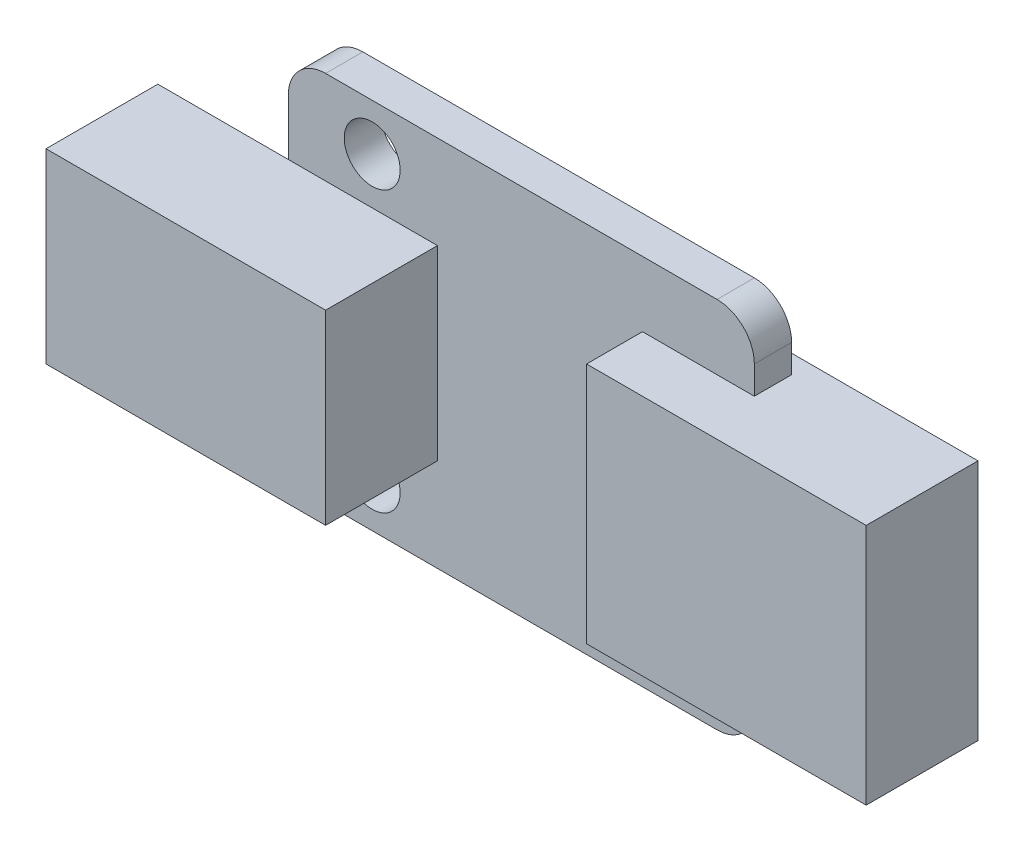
SolidWorks part; units mm, degrees
ref_plane "Front Plane" through (0, 0, 0) normal (0, 0, 1) x (1, 0, 0)
ref_plane "Top Plane" through (0, 0, 0) normal (0, 1, 0) x (1, 0, 0)
ref_plane "Right Plane" through (0, 0, 0) normal (1, 0, 0) x (0, 0, -1)
sketch "Sketch3" plane through (0, 0, 0) normal (0, 0, 1) x (1, 0, 0)
  line L1 (-12.5, 10) -> (12.5, 10)
  line L2 (-12.5, 10) -> (-12.5, -10)
  line L3 (-12.5, -10) -> (12.5, -10)
  line L4 (12.5, 10) -> (12.5, -10)
  line L5 (-12.5, 10) -> (12.5, -10) construction
  line L6 (-12.5, -10) -> (12.5, 10) construction
  circle A0 centre (-8, 7.5) radius 1.5
  circle A1 centre (-8, -7.5) radius 1.5
  point P0 (0, 0)
  dimension "D3" = 3
  dimension "D4" = 3
  dimension "D1" = 20
  dimension "D2" = 25
  dimension "D5" = 2.5
  dimension "D6" = 2.5
  dimension "D7" = 4.5
  dimension "D8" = 4.5
extrude "Boss-Extrude1" add sketch "Sketch3" along normal blind 2
sketch "Sketch4" plane through (0, 0, 2) normal (0, 0, 1) x (1, 0, 0)
  line L0 (12.5, -10) -> (12.5, 10) construction
  line L1 (6.5, -6.5) -> (21.5, -6.5)
  line L2 (6.5, -6.5) -> (6.5, 6.5)
  line L3 (6.5, 6.5) -> (21.5, 6.5)
  line L4 (21.5, -6.5) -> (21.5, 6.5)
  line L5 (6.5, -6.5) -> (21.5, 6.5) construction
  line L6 (6.5, 6.5) -> (21.5, -6.5) construction
  point P0 (14, 0)
  point P5 (16.2173, 0)
  dimension "D1" = 13
  dimension "D2" = 15
  dimension "D3" = 6
extrude "Boss-Extrude2" add sketch "Sketch4" along normal mid plane 6
sketch "Sketch5" plane through (0, 0, 2) normal (0, 0, 1) x (1, 0, 0)
  line L0 (-12.5, 10) -> (-12.5, -10) construction
  line L1 (-4.5, 5) -> (-19.5, 5)
  line L2 (-4.5, 5) -> (-4.5, -5)
  line L3 (-4.5, -5) -> (-19.5, -5)
  line L4 (-19.5, 5) -> (-19.5, -5)
  line L5 (-4.5, 5) -> (-19.5, -5) construction
  line L6 (-4.5, -5) -> (-19.5, 5) construction
  point P0 (-12, 0)
  point P7 (0, 0)
  dimension "D1" = 10
  dimension "D2" = 15
  dimension "D3" = 8
extrude "Boss-Extrude3" add sketch "Sketch5" along normal blind 6
fillet "Fillet1" radius 2 4 edges at (-12.5, 10, 1) (12.5, 10, 1) (-12.5, -10, 1) (12.5, -10, 1)
